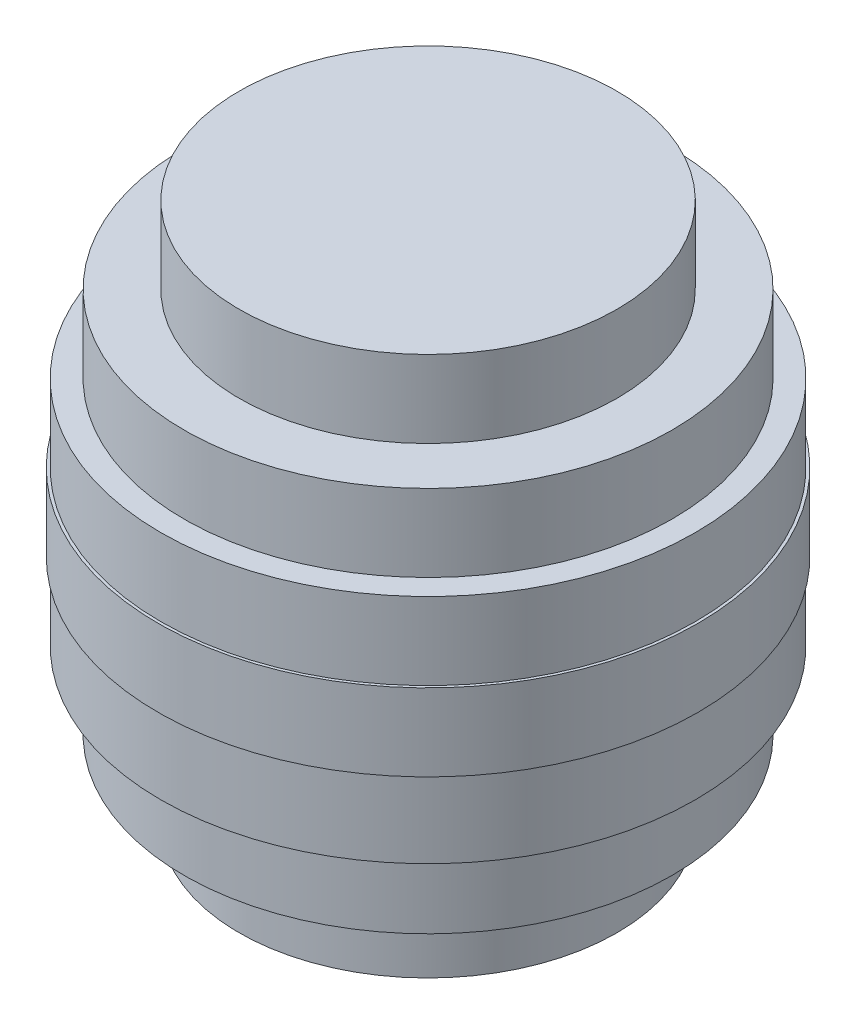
SolidWorks part; units mm, degrees
ref_plane "Front Plane" through (0, 0, 0) normal (0, 0, 1) x (1, 0, 0)
ref_plane "Top Plane" through (0, 0, 0) normal (0, 1, 0) x (1, 0, 0)
ref_plane "Right Plane" through (0, 0, 0) normal (1, 0, 0) x (0, 0, -1)
sketch "Sketch1" plane through (0, 0, 0) normal (0, 0, 1) x (1, 0, 0)
  line L0 (0, -17.5) -> (0, 17.5) construction
  line L1 (0, -17.5) -> (17.5, -17.5) construction
  line L2 (0, -12.5) -> (17.5, -12.5) construction
  line L3 (0, -7.5) -> (17.5, -7.5) construction
  line L4 (0, -2.5) -> (17.5, -2.5) construction
  line L5 (0, 2.5) -> (17.5, 2.5) construction
  line L6 (0, 7.5) -> (17.5, 7.5) construction
  line L7 (0, 12.5) -> (17.5, 12.5) construction
  arc A0 (0, 17.5) -> (0, -17.5) centre (0, 0) cw construction
  point P4 (0, 0)
  point P7 (17.5, 0)
  point P8 (0, 17.5)
sketch "Sketch2" plane through (0, 0, 0) normal (0, 0, 1) x (1, 0, 0)
  line L0 (17.5, 2.5) -> (17.5, -2.5)
  line L1 (17.5, -2.5) -> (17.3205, -2.5)
  line L2 (0, -2.5) -> (17.5, -2.5) construction
  line L3 (17.3205, -2.5) -> (17.3205, -7.5)
  line L4 (0, -7.5) -> (17.5, -7.5) construction
  line L5 (17.3205, -7.5) -> (15.8114, -7.5)
  line L6 (15.8114, -7.5) -> (15.8114, -12.5)
  line L7 (0, -12.5) -> (17.5, -12.5) construction
  line L8 (15.8114, -12.5) -> (12.2474, -12.5)
  line L9 (12.2474, -12.5) -> (12.2474, -17.5)
  line L10 (0, -17.5) -> (17.5, -17.5) construction
  line L11 (12.2474, -17.5) -> (0, -17.5)
  line L12 (0, -17.5) -> (0, 17.5)
  line L13 (0, 17.5) -> (12.2474, 17.5)
  line L14 (12.2474, 17.5) -> (12.2474, 12.5)
  line L15 (0, 12.5) -> (17.5, 12.5) construction
  line L16 (12.2474, 12.5) -> (15.8114, 12.5)
  line L17 (15.8114, 12.5) -> (15.8114, 7.5)
  line L18 (0, 7.5) -> (17.5, 7.5) construction
  line L19 (15.8114, 7.5) -> (17.3205, 7.5)
  line L20 (17.3205, 7.5) -> (17.3205, 2.5)
  line L21 (0, 2.5) -> (17.5, 2.5) construction
  line L22 (17.3205, 2.5) -> (17.5, 2.5)
  arc A0 (0, -17.5) -> (0, 17.5) centre (0, 0) ccw construction
revolve "Revolve1" add sketch "Sketch2" angle 360 about L0
equation "\"Ball Diameter\"= \"Layers\" * \"Layer Height\""
equation "\"Layers\"= 7"
equation "\"D1@Sketch1\"=\"Ball Diameter\""
equation "\"Layer Height\"= 5mm"
equation "\"D3@Sketch1\"=\"Layer Height\""
equation "\"D2@Sketch1\"=\"Layers\""
